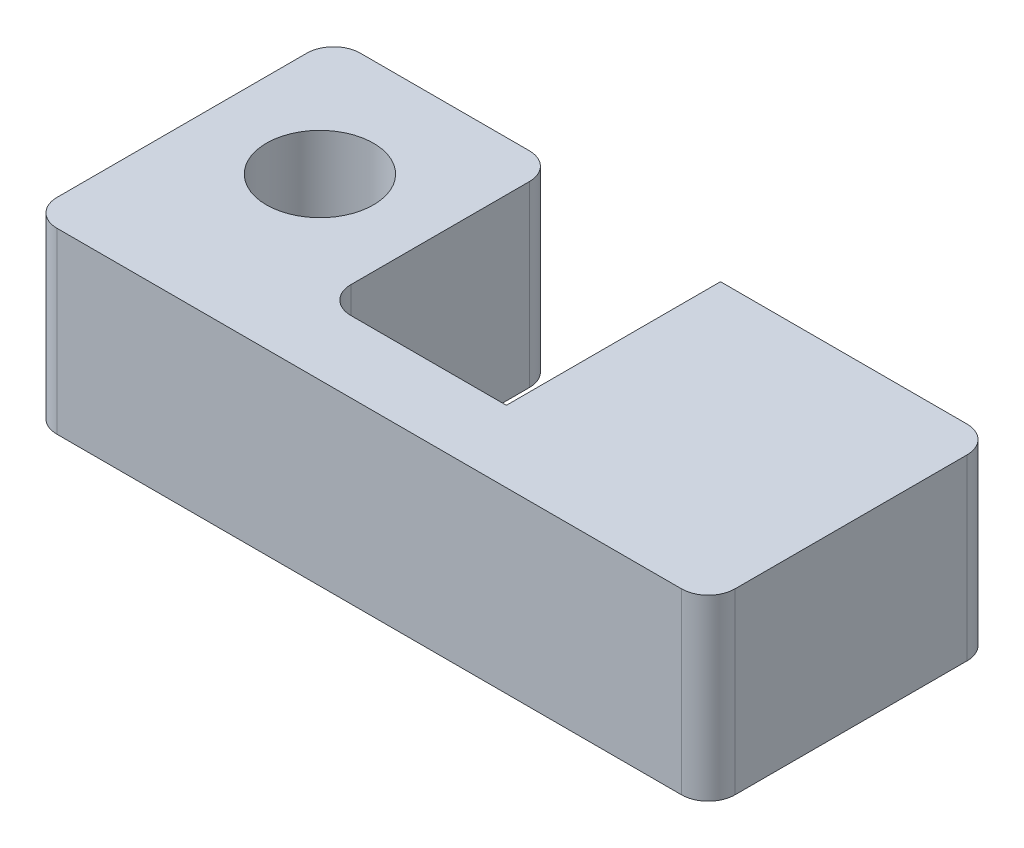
SolidWorks part; units mm, degrees
ref_plane "Спереди" through (0, 0, 0) normal (0, 0, 1) x (1, 0, 0)
ref_plane "Сверху" through (0, 0, 0) normal (0, 1, 0) x (1, 0, 0)
ref_plane "Справа" through (0, 0, 0) normal (1, 0, 0) x (0, 0, -1)
sketch "Эскиз9" plane through (0, 0, 0) normal (0, 1, 0) x (1, 0, 0)
  line L0 (6.235, 5.5) -> (6.235, -4.5)
  line L2 (31.765, 4.5) -> (31.765, -8.5)
  line L3 (30.265, -10) -> (-4.735, -10)
  line L4 (-6.235, 5.5) -> (-6.235, -8.5)
  line L7 (7.735, -6) -> (16.45, -6)
  line L8 (16.45, -6) -> (16.45, 6)
  line L9 (16.45, 6) -> (30.265, 6)
  line L10 (4.735, 7) -> (-4.735, 7)
  arc A0 (6.235, -4.5) -> (7.735, -6) centre (7.735, -4.5) ccw
  arc A1 (31.765, -8.5) -> (30.265, -10) centre (30.265, -8.5) cw
  arc A2 (-4.735, -10) -> (-6.235, -8.5) centre (-4.735, -8.5) cw
  arc A3 (-4.735, 7) -> (-6.235, 5.5) centre (-4.735, 5.5) ccw
  circle A4 centre (0, 0) radius 3
  arc A5 (6.235, 5.5) -> (4.735, 7) centre (4.735, 5.5) ccw
  arc A6 (30.265, 6) -> (31.765, 4.5) centre (30.265, 4.5) cw
  point P0 (0, 0)
  point P7 (6.235, 7)
  dimension "D3" = 7
  dimension "D5" = 6
  dimension "D9" = 1.5
  dimension "D11" = 1.5
  dimension "D12" = 1.5
  dimension "D1" = 38
  dimension "D2" = 17
  dimension "D4" = 12.47
  dimension "D6" = 1
  dimension "D7" = 16.45
  dimension "D8" = 12
  dimension "D10" = 6.235
extrude "Бобышка-Вытянуть6" add sketch "Эскиз9" against normal blind 10
sketch "Эскиз10" plane through (0, 0, -7) normal (0, 0, -1) x (-1, 0, 0)
  line L0 (-16.45, -1) -> (-28, -10)
  line L1 (-16.45, -10) -> (-16.45, 0) construction
  line L2 (-30.265, -10) -> (-16.45, -10) construction
  line L3 (-16.45, 0) -> (-7.735, 0) construction
  line L4 (-16.45, -1) -> (-16.45, -10)
  line L5 (-16.45, -10) -> (-28, -10)
  dimension "D1" = 1
  dimension "D2" = 11.55
extrude "Вырез-Вытянуть4" cut sketch "Эскиз10" against normal up to surface (13 mm away)
